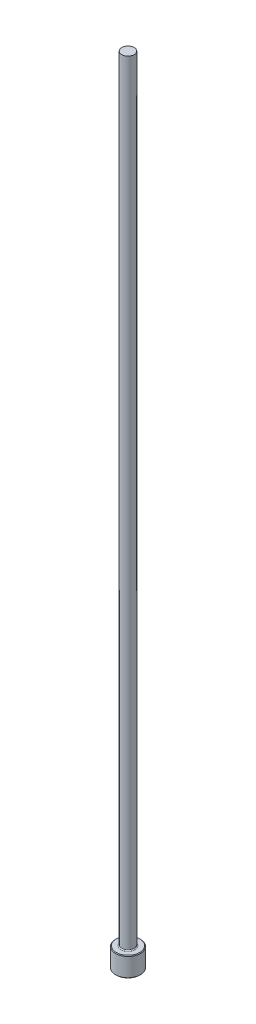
SolidWorks part; units mm, degrees
ref_plane "Front Plane" through (0, 0, 0) normal (0, 0, 1) x (1, 0, 0)
ref_plane "Top Plane" through (0, 0, 0) normal (0, 1, 0) x (1, 0, 0)
ref_plane "Right Plane" through (0, 0, 0) normal (1, 0, 0) x (0, 0, -1)
other "Configuration Table"
sketch "Sketch1" plane through (0, 0, 0) normal (0, 0, 1) x (1, 0, 0)
  line L0 (0, 259.9588) -> (0, -15.1925) construction
  line L1 (0, 0) -> (-0.9906, 0)
  line L2 (-0.9906, 0) -> (-0.9906, 1.5748)
  line L3 (-0.9906, 1.5748) -> (-0.4953, 1.5748)
  line L4 (-0.4953, 1.5748) -> (-0.4953, 63.5)
  line L5 (-0.4953, 63.5) -> (0, 63.5)
  line L6 (0, 63.5) -> (0, 0)
  dimension "L" = 63.5
  dimension "H" = 1.9812
  dimension "T" = 1.5748
  dimension "D" = 0.9906
revolve "Revolve1" add sketch "Sketch1" angle 360 about L0
chamfer "Chamfer1" distance 0.0508 angle 45 2 edges at (0, 1.5748, 0.9906) (0, 0, 0.9906)
fillet "Fillet1" radius 0.0762 1 edges at (0, 1.5748, 0.4953)
